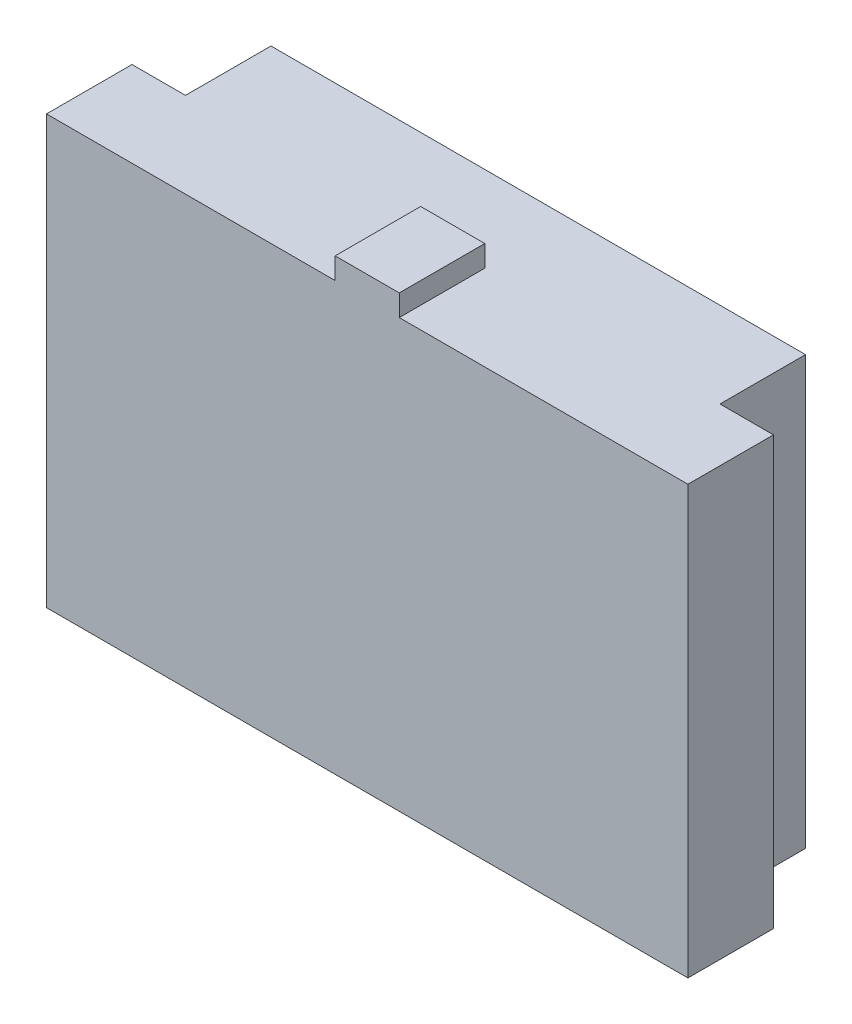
SolidWorks part; units mm, degrees
ref_plane "Plan de face" through (0, 0, 0) normal (0, 0, 1) x (1, 0, 0)
ref_plane "Plan de dessus" through (0, 0, 0) normal (0, 1, 0) x (1, 0, 0)
ref_plane "Plan de droite" through (0, 0, 0) normal (1, 0, 0) x (0, 0, -1)
sketch "Esquisse1" plane through (0, 0, 0) normal (0, 0, 1) x (1, 0, 0)
  line L0 (0, 40) -> (0, 0)
  line L1 (0, 0) -> (60, 0)
  line L7 (0, 40) -> (27, 40)
  line L8 (27, 42) -> (27, 40)
  line L11 (60, 40) -> (33, 40)
  line L12 (33, 42) -> (33, 40)
  line L13 (60, 40) -> (60, 0)
  line L14 (33, 42) -> (27, 42)
  point P11 (33, 41)
  point P12 (27, 41)
  dimension "D1" = 60
  dimension "D2" = 40
  dimension "D3" = 6
  dimension "D4" = 2
  dimension "D5" = 27
  dimension "D6" = 40
extrude "Boss.-Extru.1" add sketch "Esquisse1" along normal blind 8
sketch "Esquisse3" plane through (0, 0, 0) normal (0, 0, -1) x (-1, 0, 0)
  line L0 (-60, 40) -> (-33, 40) construction
  line L1 (-55, 40) -> (-5, 40)
  line L2 (-55, 40) -> (-55, 0)
  line L3 (-55, 0) -> (-5, 0)
  line L4 (-5, 40) -> (-5, 0)
  line L5 (0, 0) -> (-60, 0) construction
  line L6 (0, 40) -> (0, 0) construction
  line L7 (-60, 0) -> (-60, 40) construction
  dimension "D1" = 5
  dimension "D2" = 5
extrude "Boss.-Extru.3" add sketch "Esquisse3" along normal blind 8
